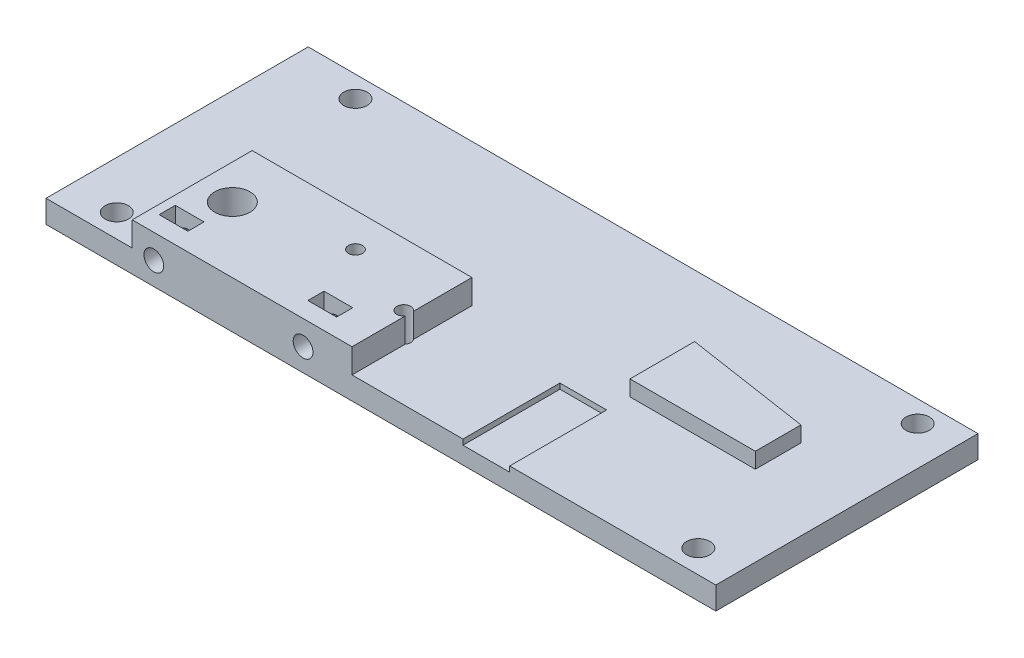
SolidWorks part; units mm, degrees
ref_plane "Front Plane" through (0, 0, 0) normal (0, 0, 1) x (1, 0, 0)
ref_plane "Top Plane" through (0, 0, 0) normal (0, 1, 0) x (1, 0, 0)
ref_plane "Right Plane" through (0, 0, 0) normal (1, 0, 0) x (0, 0, -1)
sketch "Sketch1" plane through (0, 0, 0) normal (0, 1, 0) x (1, 0, 0)
  line L1 (-93.25, -36.5) -> (93.25, -36.5)
  line L2 (-93.25, -36.5) -> (-93.25, 36.5)
  line L3 (-93.25, 36.5) -> (93.25, 36.5)
  line L4 (93.25, -36.5) -> (93.25, 36.5)
  line L5 (-93.25, -36.5) -> (93.25, 36.5) construction
  line L6 (-93.25, 36.5) -> (93.25, -36.5) construction
  point P0 (0, 0)
  dimension "D1" = 186.5
  dimension "D2" = 73
extrude "Boss-Extrude1" add sketch "Sketch1" along normal blind 6.3
sketch "Sketch2" plane through (0, 6.3, 0) normal (0, 1, 0) x (1, 0, 0)
  line L6 (-93.25, -36.5) -> (93.25, -36.5) construction
  line L7 (-69.25, -36.5) -> (-8.05, -36.5)
  line L8 (-69.25, -36.5) -> (-69.25, -3.1)
  line L9 (-69.25, -3.1) -> (-8.05, -3.1)
  line L10 (-8.05, -36.5) -> (-8.05, -3.1)
  line L11 (-93.25, 36.5) -> (-93.25, -36.5) construction
  dimension "D4" = 33.4
  dimension "D5" = 61.2
  dimension "D6" = 24
extrude "Boss-Extrude2" add sketch "Sketch2" along normal blind 6.8
sketch "Sketch3" plane through (0, 6.3, 0) normal (0, 1, 0) x (1, 0, 0)
  line L11 (35.95, -23.1) -> (70.85, -23.1)
  line L12 (70.85, -23.1) -> (70.85, 9.6)
  line L13 (70.85, 9.6) -> (35.95, 14.9)
  line L14 (35.95, 14.9) -> (35.95, -23.1)
  line L15 (-93.25, -36.5) -> (-69.25, -36.5) construction
  line L16 (93.25, -36.5) -> (93.25, 36.5) construction
  dimension "D6" = 32.7
  dimension "D7" = 38
  dimension "D8" = 34.9
  dimension "D9" = 13.4
  dimension "D10" = 22.4
extrude "Boss-Extrude3" add sketch "Sketch3" along normal blind 4.35
sketch "Sketch4" plane through (0, 0, 0) normal (0, -1, 0) x (1, 0, 0)
  circle A0 centre (-80, 30.05) radius 3.25
  circle A1 centre (-74.15, -30.55) radius 3.25
  circle A2 centre (82.45, -30.5) radius 3.25
  circle A3 centre (81.925, 30.05) radius 3.25
  circle A4 centre (-59.6038, 18.2644) radius 4.925
  circle A5 centre (-31.0288, 12.5494) radius 1.95
  circle A6 centre (-9.6166, 20.525) radius 1.95
  circle A7 centre (-80, 30.05) radius 3.25 construction
  circle A8 centre (-74.15, -30.55) radius 3.25 construction
  circle A9 centre (81.925, 30.05) radius 3.25 construction
  circle A10 centre (-59.6038, 18.2644) radius 4.925 construction
  circle A11 centre (-31.0288, 12.5494) radius 1.95 construction
  circle A12 centre (-9.6166, 20.525) radius 1.95 construction
  circle A13 centre (82.45, -30.5) radius 3.25 construction
extrude "Cut-Extrude1" cut sketch "Sketch4" against normal through all
sketch "Sketch5" plane through (0, 0, 36.5) normal (0, 0, 1) x (1, 0, 0)
  circle A0 centre (-63.225, 6.325) radius 2.75
  circle A1 centre (-21.675, 6.325) radius 2.75
  circle A2 centre (-63.225, 6.325) radius 2.75 construction
  circle A3 centre (-21.675, 6.325) radius 2.75 construction
  dimension "D1" = 5.5
extrude "Cut-Extrude2" cut sketch "Sketch5" against normal blind 12
sketch "Sketch7" plane through (0, 0, 0) normal (0, -1, 0) x (1, 0, 0)
  line L0 (-66.75, 31.5) -> (-58.75, 31.5) construction
  line L1 (-66.75, 31.5) -> (-58.75, 31.5)
  line L2 (-66.75, 31.5) -> (-66.75, 27)
  line L3 (-66.75, 27) -> (-58.75, 27)
  line L4 (-58.75, 31.5) -> (-58.75, 27)
  line L5 (-25.35, 31.5) -> (-17.35, 31.5)
  line L6 (-25.35, 31.5) -> (-25.35, 27)
  line L7 (-25.35, 27) -> (-17.35, 27)
  line L8 (-17.35, 31.5) -> (-17.35, 27)
  line L9 (-66.75, 27) -> (-66.75, 31.5) construction
  line L10 (-25.35, 31.5) -> (-17.35, 31.5) construction
  line L11 (-25.35, 27) -> (-25.35, 31.5) construction
extrude "Cut-Extrude3" cut sketch "Sketch7" against normal through all
sketch "Sketch8" plane through (0, 10.65, 0) normal (0, 1, 0) x (1, 0, 0)
  line L1 (70.85, -3.1) -> (35.95, -3.1)
  line L2 (70.85, -3.1) -> (70.85, -23.1)
  line L3 (70.85, -23.1) -> (35.95, -23.1)
  line L4 (35.95, -3.1) -> (35.95, -23.1)
  line L7 (35.95, -23.1) -> (70.85, -23.1) construction
  line L8 (35.95, 14.9) -> (35.95, -23.1) construction
  line L9 (70.85, -23.1) -> (70.85, 9.6) construction
  point P6 (33.34, -17.1976)
  point P9 (0, 0)
  dimension "D1" = 20
extrude "Cut-Extrude4" cut sketch "Sketch8" against normal up to surface (4.35 mm away)
sketch "Sketch9" plane through (0, 6.3, 0) normal (0, 1, 0) x (1, 0, 0)
  line L0 (-8.05, -36.5) -> (93.25, -36.5) construction
  line L1 (35.85, -36.5) -> (22.85, -36.5)
  line L2 (35.85, -36.5) -> (35.85, -9.5)
  line L3 (35.85, -9.5) -> (22.85, -9.5)
  line L4 (22.85, -36.5) -> (22.85, -9.5)
  line L5 (93.25, -36.5) -> (93.25, 36.5) construction
  dimension "D1" = 13
  dimension "D2" = 57.4
  dimension "D3" = 27
extrude "Cut-Extrude5" cut sketch "Sketch9" against normal blind 1.5
